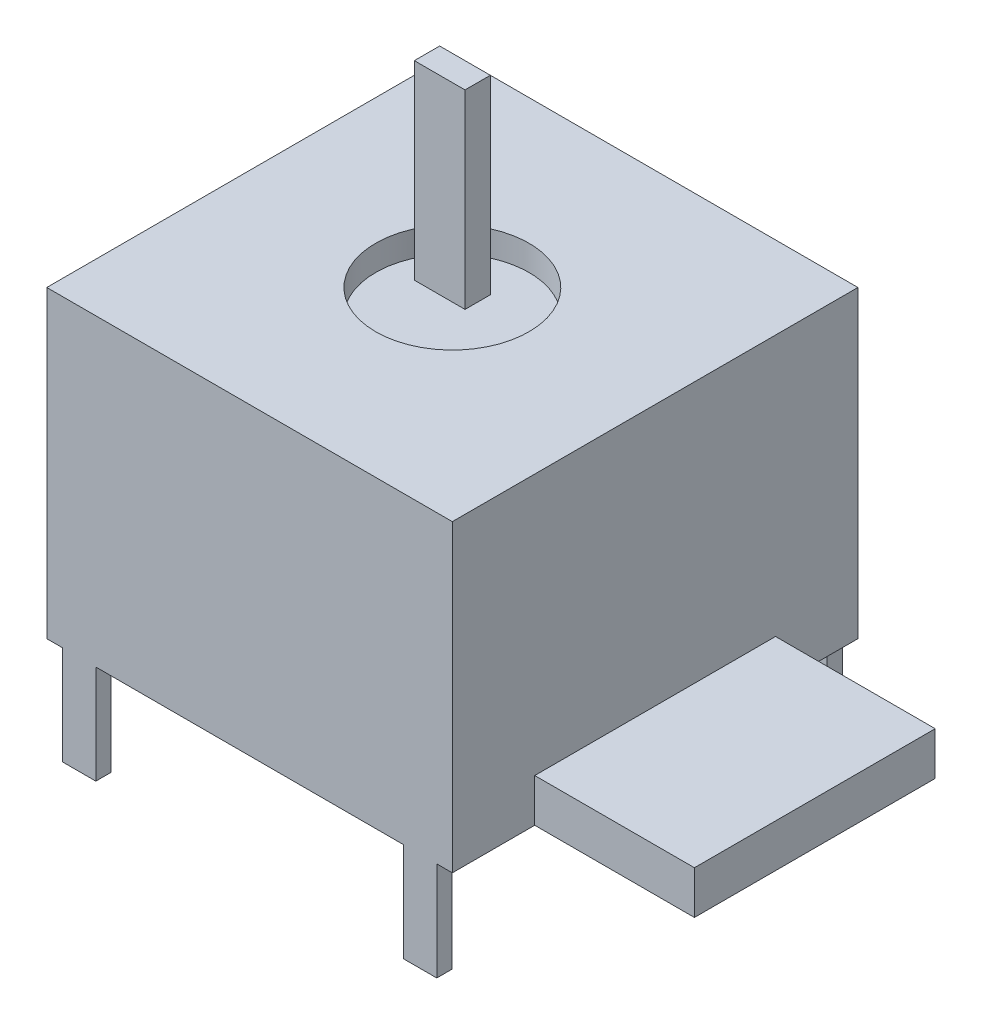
SolidWorks part; units mm, degrees
ref_plane "Plan de face" through (0, 0, 0) normal (0, 0, 1) x (1, 0, 0)
ref_plane "Plan de dessus" through (0, 0, 0) normal (0, 1, 0) x (1, 0, 0)
ref_plane "Plan de droite" through (0, 0, 0) normal (1, 0, 0) x (0, 0, -1)
sketch "Esquisse1" plane through (0, 0, 0) normal (0, 1, 0) x (1, 0, 0)
  line L1 (0, 0) -> (16, 0)
  line L2 (0, 0) -> (0, 16)
  line L3 (0, 16) -> (16, 16)
  line L4 (16, 0) -> (16, 16)
  dimension "D1" = 16
  dimension "D2" = 16
extrude "Extrusion1" add sketch "Esquisse1" along normal blind 12
sketch "Esquisse2" plane through (16, 0, 0) normal (1, 0, 0) x (0, 0, -1)
  line L0 (0, 0) -> (16, 0) construction
  line L1 (3.25, 0) -> (12.75, 0)
  line L2 (3.25, 0) -> (3.25, 1.7)
  line L3 (3.25, 1.7) -> (12.75, 1.7)
  line L4 (12.75, 0) -> (12.75, 1.7)
  line L5 (8, 1.7) -> (8, 3.2248) construction
  line L6 (8, 12) -> (8, 9.9778) construction
  line L7 (0, 12) -> (16, 12) construction
  dimension "D1" = 1.7
  dimension "D2" = 9.5
extrude "Extrusion2" add sketch "Esquisse2" along normal blind 6.3
sketch "Esquisse3" plane through (0, 0, 0) normal (0, -1, 0) x (1, 0, 0)
  line L0 (8, 0) -> (8, -2.4467) construction
  line L1 (0.615, 0) -> (1.935, 0)
  line L2 (0.615, 0) -> (0.615, -0.6)
  line L3 (0.615, -0.6) -> (1.935, -0.6)
  line L4 (1.935, 0) -> (1.935, -0.6)
  line L5 (14.065, 0) -> (15.385, 0)
  line L6 (14.065, 0) -> (14.065, -0.6)
  line L7 (14.065, -0.6) -> (15.385, -0.6)
  line L8 (15.385, 0) -> (15.385, -0.6)
  line L9 (0, 0) -> (16, 0) construction
  line L10 (0, -8) -> (22.3, -8) construction
  line L11 (0, -16) -> (0, 0) construction
  line L12 (22.3, -3.25) -> (22.3, -12.75) construction
  line L13 (15.385, -16) -> (15.385, -15.4)
  line L14 (14.065, -15.4) -> (15.385, -15.4)
  line L15 (14.065, -16) -> (14.065, -15.4)
  line L16 (14.065, -16) -> (15.385, -16)
  line L17 (1.935, -16) -> (1.935, -15.4)
  line L18 (0.615, -15.4) -> (1.935, -15.4)
  line L19 (0.615, -16) -> (0.615, -15.4)
  line L20 (0.615, -16) -> (1.935, -16)
  dimension "D1" = 14.77
  dimension "D2" = 1.32
  dimension "D3" = 1.32
  dimension "D4" = 6.065
  dimension "D5" = 0.6
  dimension "D6" = 0.6
extrude "Extrusion3" add sketch "Esquisse3" along normal blind 3.9
sketch "Esquisse5" plane through (0, 12, 0) normal (0, 1, 0) x (-1, 0, 0)
  line L0 (-8, -16) -> (-8, 0) construction
  line L1 (-16, -16) -> (0, -16) construction
  line L2 (0, 0) -> (-16, 0) construction
  line L3 (-16, -8) -> (-3.1501, -8) construction
  line L4 (-16, 0) -> (-16, -16) construction
  circle A0 centre (-8, -8) radius 3.0257
sketch "Esquisse4" plane through (0, 12, 0) normal (0, 1, 0) x (-1, 0, 0)
  line L0 (-16, -16) -> (0, 0) construction
  line L1 (-9, -8.5) -> (-7, -7.5) construction
  line L2 (-9, -8.5) -> (-7, -8.5)
  line L3 (-9, -8.5) -> (-9, -7.5)
  line L4 (-9, -7.5) -> (-7, -7.5)
  line L5 (-7, -8.5) -> (-7, -7.5)
  line L7 (-16, 0) -> (0, -16) construction
  point P12 (-8, -8)
  point P13 (-8, -8)
  dimension "D1" = 2
  dimension "D2" = 1
extrude "Extrusion4" add sketch "Esquisse4" along normal blind 7.5
extrude "Enlèv. mat.-Extru.2" cut sketch "Esquisse5" against normal blind 1
